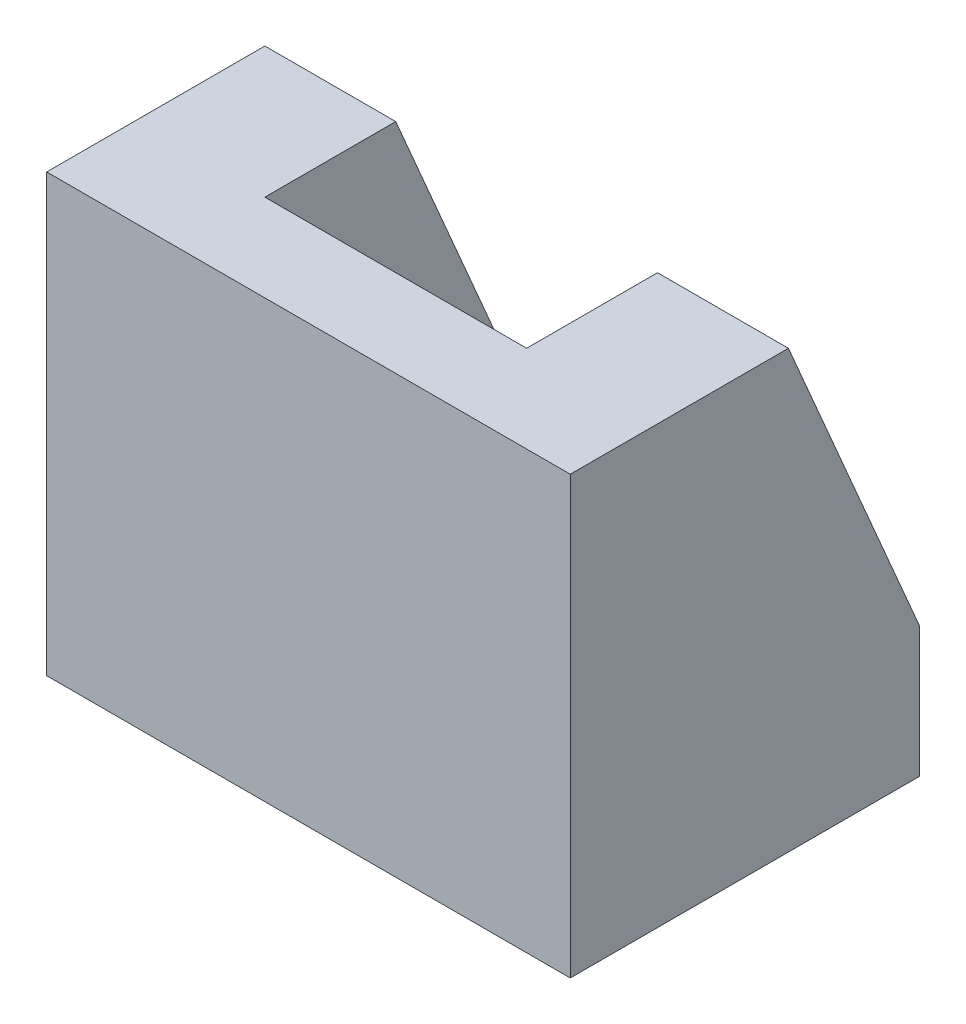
SolidWorks part; units mm, degrees
ref_plane "前视基准面" through (0, 0, 0) normal (0, 0, 1) x (1, 0, 0)
ref_plane "上视基准面" through (0, 0, 0) normal (0, 1, 0) x (1, 0, 0)
ref_plane "右视基准面" through (0, 0, 0) normal (1, 0, 0) x (0, 0, -1)
sketch "草图1" plane through (0, 0, 0) normal (1, 0, 0) x (0, 0, -1)
  line L0 (50, 100) -> (80, 30)
  line L1 (0, 0) -> (80, 0)
  line L2 (0, 0) -> (0, 100)
  line L3 (0, 100) -> (50, 100)
  line L4 (80, 0) -> (80, 30)
  dimension "D1" = 100
  dimension "D2" = 80
  dimension "D3" = 30
  dimension "D4" = 50
extrude "拉伸1" add sketch "草图1" along normal blind 120
sketch "草图2" plane through (0, 100, 0) normal (0, 1, 0) x (1, 0, 0)
  line L0 (60, 0) -> (60, 92.2989) construction
  line L1 (120, 0) -> (0, 0) construction
  line L2 (90, 0) -> (30, 0) construction
  line L3 (30, 20) -> (30, 80)
  line L4 (120, 80) -> (0, 80) construction
  line L5 (30, 80) -> (90, 80)
  line L6 (90, 80) -> (90, 20)
  line L7 (30, 20) -> (90, 20)
  dimension "D1" = 60
  dimension "D2" = 20
extrude "切除-拉伸1" cut sketch "草图2" against normal blind 70
